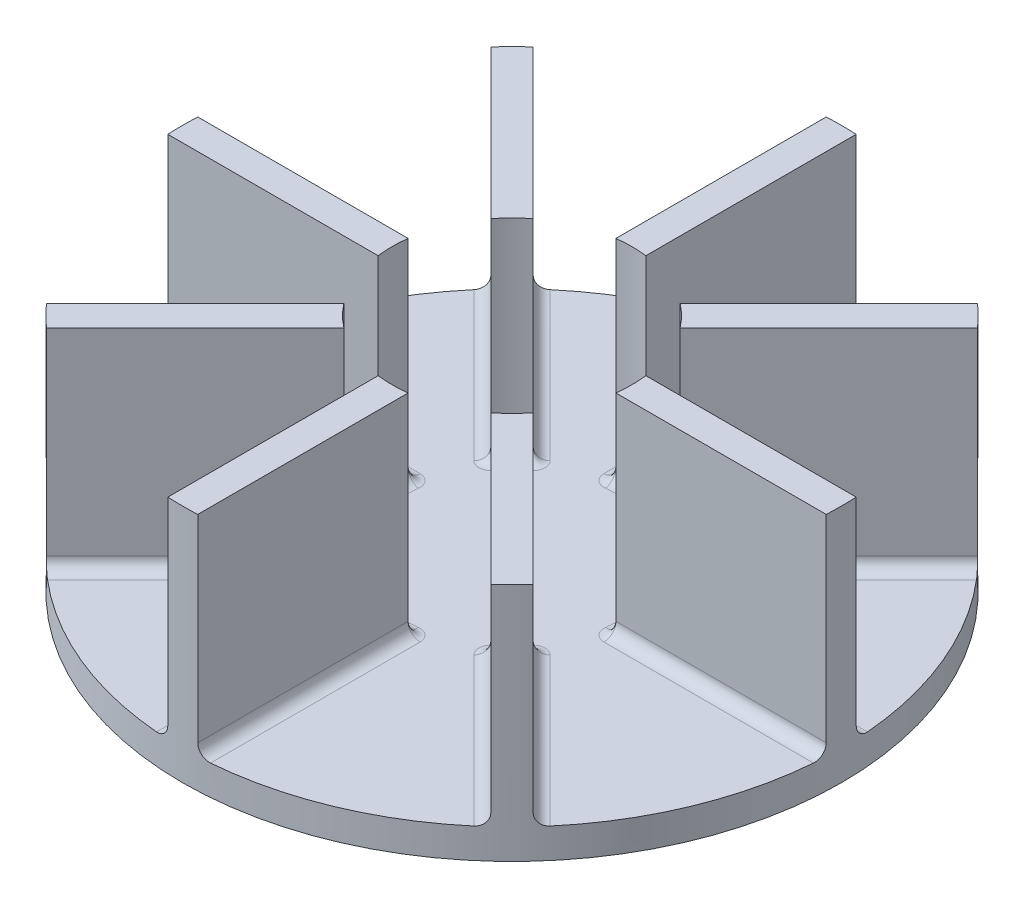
SolidWorks part; units mm, degrees
ref_plane "Front Plane" through (0, 0, 0) normal (0, 0, 1) x (1, 0, 0)
ref_plane "Top Plane" through (0, 0, 0) normal (0, 1, 0) x (1, 0, 0)
ref_plane "Right Plane" through (0, 0, 0) normal (1, 0, 0) x (0, 0, -1)
sketch "Sketch1" plane through (0, 0, 0) normal (0, 1, 0) x (1, 0, 0)
  circle A0 centre (0, 0) radius 55
  dimension "D1" = 110
extrude "Boss-Extrude1" add sketch "Sketch1" against normal blind 5
sketch "Sketch2" plane through (0, 0, 0) normal (0, 1, 0) x (1, 0, 0)
  line L0 (0, 55) -> (0, 0) construction
  line L1 (-2.5, 54.9432) -> (-2.5, 19.8431)
  line L2 (2.5, 54.9432) -> (2.5, 19.8431)
  line L3 (40.6184, 37.0829) -> (15.799, 12.2634)
  line L4 (2.5, 55) -> (2.5, 20) construction
  line L5 (-2.5, 55) -> (-2.5, 20) construction
  line L6 (37.0829, 40.6184) -> (12.2634, 15.799)
  line L7 (54.9432, -2.5) -> (19.8431, -2.5)
  line L8 (54.9432, 2.5) -> (19.8431, 2.5)
  line L9 (37.0829, -40.6184) -> (12.2634, -15.799)
  line L10 (40.6184, -37.0829) -> (15.799, -12.2634)
  line L11 (-2.5, -54.9432) -> (-2.5, -19.8431)
  line L12 (2.5, -54.9432) -> (2.5, -19.8431)
  line L13 (-40.6184, -37.0829) -> (-15.799, -12.2634)
  line L14 (-37.0829, -40.6184) -> (-12.2634, -15.799)
  line L15 (-54.9432, 2.5) -> (-19.8431, 2.5)
  line L16 (-54.9432, -2.5) -> (-19.8431, -2.5)
  line L17 (-37.0829, 40.6184) -> (-12.2634, 15.799)
  line L18 (-40.6184, 37.0829) -> (-15.799, 12.2634)
  line L19 (0, 0) -> (2.5, 19.8431) construction
  line L20 (0, 0) -> (15.799, 12.2634) construction
  line L26 (0, 55) -> (0, 20) construction
  arc A0 (2.5, 19.8431) -> (-2.5, 19.8431) centre (0, 0) ccw
  arc A1 (2.5, 54.9432) -> (-2.5, 54.9432) centre (0, 0) ccw
  circle A2 centre (0, 0) radius 55 construction
  arc A3 (40.6184, 37.0829) -> (37.0829, 40.6184) centre (0, 0) ccw
  arc A4 (15.799, 12.2634) -> (12.2634, 15.799) centre (0, 0) ccw
  arc A5 (54.9432, -2.5) -> (54.9432, 2.5) centre (0, 0) ccw
  arc A6 (19.8431, -2.5) -> (19.8431, 2.5) centre (0, 0) ccw
  arc A7 (37.0829, -40.6184) -> (40.6184, -37.0829) centre (0, 0) ccw
  arc A8 (12.2634, -15.799) -> (15.799, -12.2634) centre (0, 0) ccw
  arc A9 (-2.5, -54.9432) -> (2.5, -54.9432) centre (0, 0) ccw
  arc A10 (-2.5, -19.8431) -> (2.5, -19.8431) centre (0, 0) ccw
  arc A11 (-40.6184, -37.0829) -> (-37.0829, -40.6184) centre (0, 0) ccw
  arc A12 (-15.799, -12.2634) -> (-12.2634, -15.799) centre (0, 0) ccw
  arc A13 (-54.9432, 2.5) -> (-54.9432, -2.5) centre (0, 0) ccw
  arc A14 (-19.8431, 2.5) -> (-19.8431, -2.5) centre (0, 0) ccw
  arc A15 (-37.0829, 40.6184) -> (-40.6184, 37.0829) centre (0, 0) ccw
  arc A16 (-12.2634, 15.799) -> (-15.799, 12.2634) centre (0, 0) ccw
  point P45 (0, 0)
  point P58 (0, 0)
  dimension "D1" = 8
  dimension "D3" = 20
  dimension "D4" = 45
  dimension "D2" = 5
extrude "Boss-Extrude2" add sketch "Sketch2" along normal blind 35
fillet "Fillet1" radius 2 24 edges at (-14.1421, 0, -14.1421) (-28.2087, 0, -24.6732) (-20, 0, 0) (-37.3931, 0, -2.5) (-37.3931, 0, 2.5) (-14.1421, 0, 14.1421) (-28.2087, 0, 24.6732) (-24.6732, 0, 28.2087) (0, 0, 20) (-2.5, 0, 37.3931) (2.5, 0, 37.3931) (14.1421, 0, 14.1421) (24.6732, 0, 28.2087) (28.2087, 0, 24.6732) (20, 0, 0) (37.3931, 0, 2.5) (37.3931, 0, -2.5) (14.1421, 0, -14.1421) (28.2087, 0, -24.6732) (24.6732, 0, -28.2087) (0, 0, -20) (2.5, 0, -37.3931) (-2.5, 0, -37.3931) (-24.6732, 0, -28.2087)
